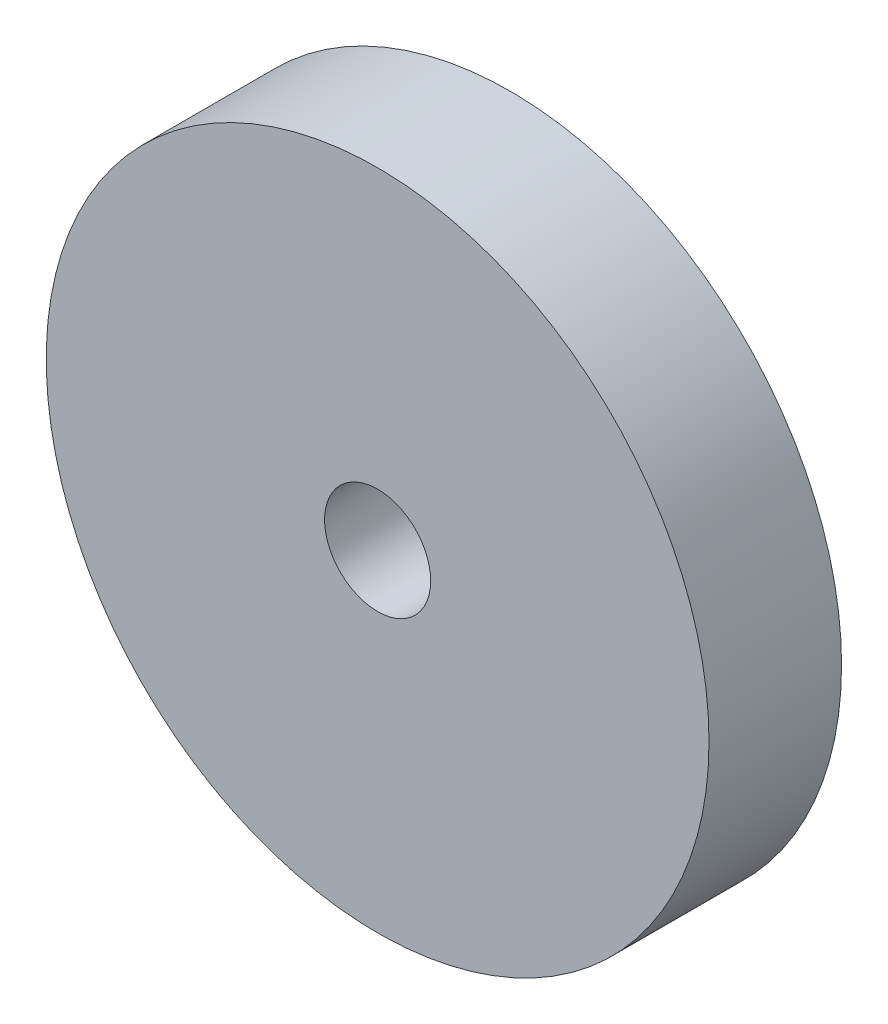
SolidWorks part; units mm, degrees
ref_plane "Front Plane" through (0, 0, 0) normal (0, 0, 1) x (1, 0, 0)
ref_plane "Top Plane" through (0, 0, 0) normal (0, 1, 0) x (1, 0, 0)
ref_plane "Right Plane" through (0, 0, 0) normal (1, 0, 0) x (0, 0, -1)
sketch "Sketch1" plane through (0, 0, 0) normal (0, 0, 1) x (1, 0, 0)
  circle A0 centre (0, 0) radius 25
  circle A1 centre (0, 0) radius 4
  dimension "D1" = 50
  dimension "D2" = 8
extrude "Boss-Extrude2" add sketch "Sketch1" along normal blind 10
